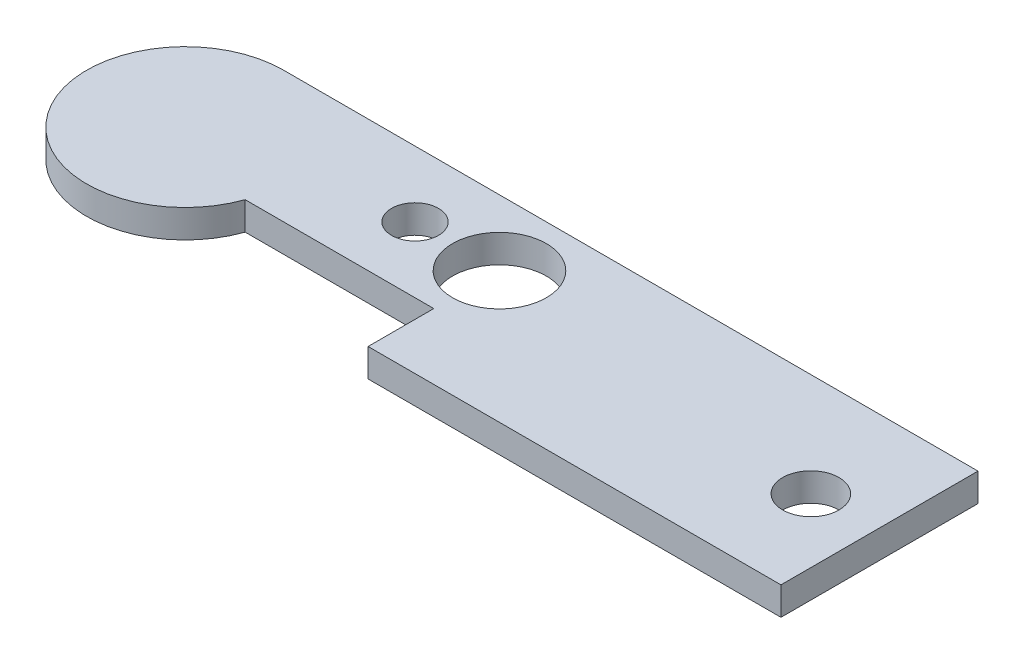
SolidWorks part; units mm, degrees
ref_plane "Front" through (0, 0, 0) normal (0, 0, 1) x (1, 0, 0)
ref_plane "Top" through (0, 0, 0) normal (0, 1, 0) x (1, 0, 0)
ref_plane "Right" through (0, 0, 0) normal (1, 0, 0) x (0, 0, -1)
sketch "Sketch1" plane through (0, 0, 0) normal (0, 1, 0) x (1, 0, 0)
  line L0 (40.5, 0) -> (84.5, 0)
  line L1 (20.3995, 7) -> (40.5, 7)
  line L3 (10.5, 21) -> (84.5, 21)
  line L4 (84.5, 0) -> (84.5, 21)
  line L6 (40.5, 0) -> (40.5, 21) construction
  line L8 (40.5, 0) -> (40.5, 7)
  arc A0 (10.5, 21) -> (20.3995, 7) centre (10.5, 10.5) ccw
  circle A1 centre (31.5, 14) radius 2.5
  circle A2 centre (40.5, 14) radius 5
  circle A4 centre (77.6855, 10) radius 3
extrude "Extrude2" add sketch "Sketch1" along normal blind 3
